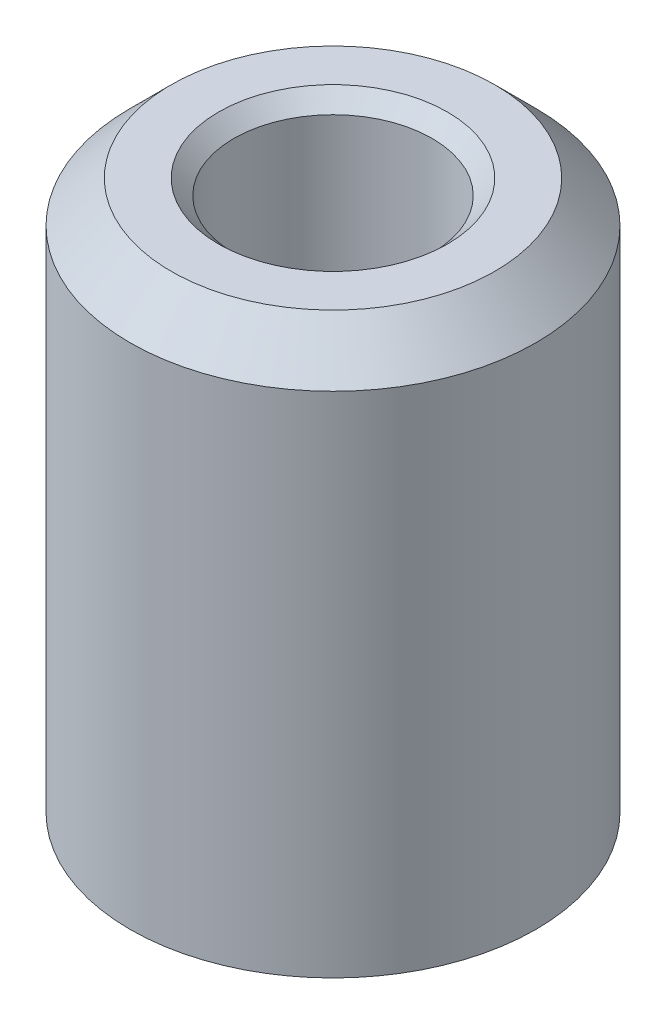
SolidWorks part; units mm, degrees
ref_plane "Přední rovina" through (0, 0, 0) normal (0, 0, 1) x (1, 0, 0)
ref_plane "Horní rovina" through (0, 0, 0) normal (0, 1, 0) x (1, 0, 0)
ref_plane "Pravá rovina" through (0, 0, 0) normal (1, 0, 0) x (0, 0, -1)
sketch "Skica1" plane through (0, 0, 0) normal (0, 1, 0) x (1, 0, 0)
  circle A0 centre (0, 0) radius 6.65
  dimension "D1" = 13.3
extrude "Přidat vysunutím1" add sketch "Skica1" along normal blind 18
chamfer "Zkosení1" distance 1.35 angle 45 1 edges at (0, 18, 6.65)
sketch "Skica2" plane through (0, 18, 0) normal (0, 1, 0) x (1, 0, 0)
  circle A0 centre (0, 0) radius 3.25
  dimension "D1" = 6.5
extrude "Odebrat vysunutím1" cut sketch "Skica2" against normal through all
chamfer "Zkosení2" distance 0.5 angle 45 1 edges at (0, 18, 3.25)
